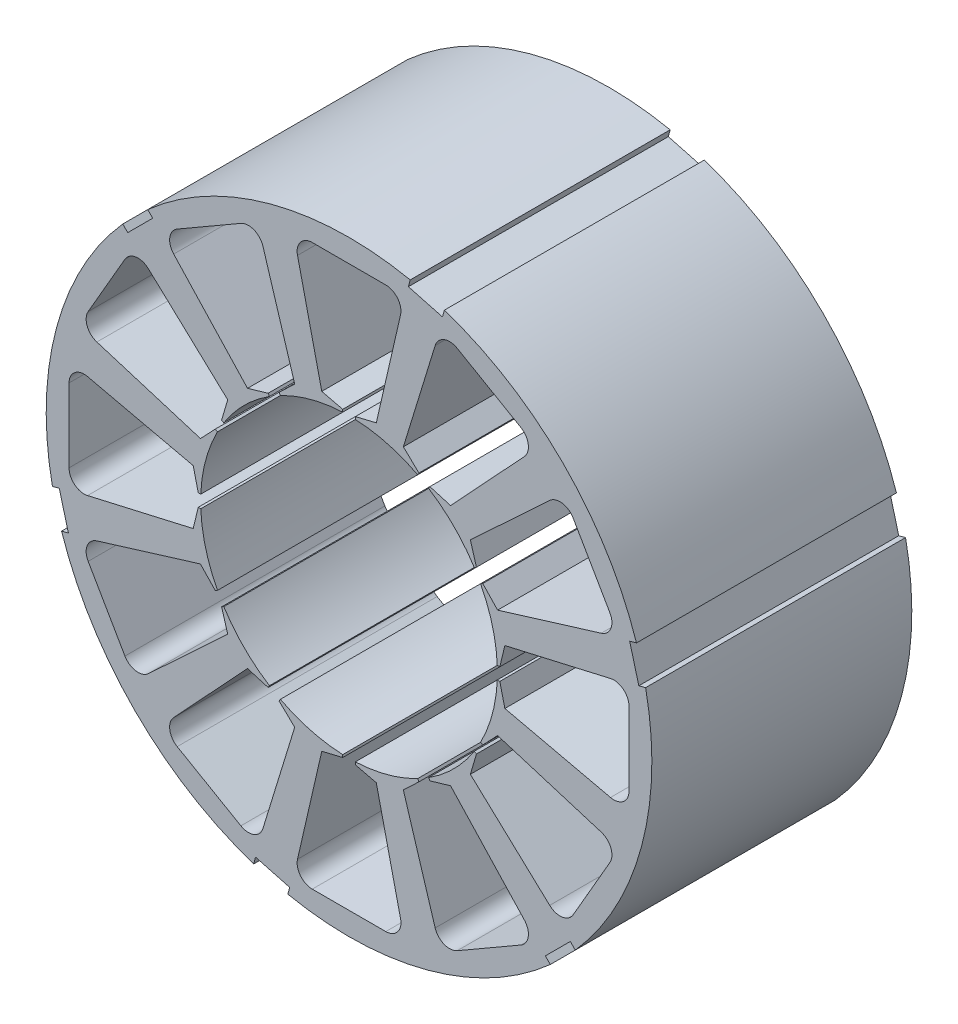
SolidWorks part; units mm, degrees
ref_plane "Přední rovina" through (0, 0, 0) normal (0, 0, 1) x (1, 0, 0)
ref_plane "Horní rovina" through (0, 0, 0) normal (0, 1, 0) x (1, 0, 0)
ref_plane "Pravá rovina" through (0, 0, 0) normal (1, 0, 0) x (0, 0, -1)
sketch "Skica1" plane through (0, 0, 0) normal (0, 0, 1) x (1, 0, 0)
  line L0 (0, 102.7157) -> (0, 0) construction
  line L1 (0, 0) -> (102.7157, 0) construction
  circle A0 centre (0, 0) radius 60
  dimension "D1" = 120
extrude "Přidat vysunutím1" add sketch "Skica1" along normal blind 51.5
sketch "Skica2" plane through (0, 0, 51.5) normal (0, 0, 1) x (1, 0, 0)
  circle A0 centre (0, 0) radius 29.4
  dimension "D1" = 58.8
extrude "Odebrat vysunutím1" cut sketch "Skica2" against normal blind 51.5
sketch "Skica3" plane through (0, 0, 51.5) normal (0, 0, 1) x (1, 0, 0)
  line L2 (0, 0) -> (0, 60) construction
  line L124 (1.25, 29.3734) -> (-1.25, 29.3734)
  line L422 (60, 0) -> (0, 0) construction
  line L423 (1.25, 29.3734) -> (1.25, 29.8734)
  line L424 (1.25, 29.8734) -> (5.4, 30.8734)
  line L425 (5.4, 30.8734) -> (10.2067, 51.8019)
  line L426 (7.2829, 55.4734) -> (-7.2829, 55.4734)
  line L427 (-5.4, 30.8734) -> (-10.2067, 51.8019)
  line L428 (-1.25, 29.8734) -> (-5.4, 30.8734)
  line L429 (-1.25, 29.3734) -> (-1.25, 29.8734)
  line L430 (20.1132, 24.0372) -> (34.7402, 39.7584)
  line L431 (34.0439, 44.4) -> (21.4296, 51.6828)
  line L432 (10.7602, 29.4372) -> (17.0616, 49.9651)
  line L433 (15.7692, 24.8131) -> (13.6042, 26.0631)
  line L434 (13.6042, 26.0631) -> (13.8542, 26.4961)
  line L435 (15.7692, 24.8131) -> (16.0192, 25.2461)
  line L436 (16.0192, 25.2461) -> (20.1132, 24.0372)
  line L437 (13.8542, 26.4961) -> (10.7602, 29.4372)
  line L438 (29.4372, 10.7602) -> (49.9651, 17.0616)
  line L439 (51.6828, 21.4296) -> (44.4, 34.0439)
  line L440 (24.0372, 20.1132) -> (39.7584, 34.7402)
  line L441 (26.0631, 13.6042) -> (24.8131, 15.7692)
  line L442 (24.8131, 15.7692) -> (25.2461, 16.0192)
  line L443 (26.0631, 13.6042) -> (26.4961, 13.8542)
  line L444 (26.4961, 13.8542) -> (29.4372, 10.7602)
  line L445 (25.2461, 16.0192) -> (24.0372, 20.1132)
  line L446 (30.8734, -5.4) -> (51.8019, -10.2067)
  line L447 (55.4734, -7.2829) -> (55.4734, 7.2829)
  line L448 (30.8734, 5.4) -> (51.8019, 10.2067)
  line L449 (29.3734, -1.25) -> (29.3734, 1.25)
  line L450 (29.3734, 1.25) -> (29.8734, 1.25)
  line L451 (29.3734, -1.25) -> (29.8734, -1.25)
  line L452 (29.8734, -1.25) -> (30.8734, -5.4)
  line L453 (29.8734, 1.25) -> (30.8734, 5.4)
  line L454 (24.0372, -20.1132) -> (39.7584, -34.7402)
  line L455 (44.4, -34.0439) -> (51.6828, -21.4296)
  line L456 (29.4372, -10.7602) -> (49.9651, -17.0616)
  line L457 (24.8131, -15.7692) -> (26.0631, -13.6042)
  line L458 (26.0631, -13.6042) -> (26.4961, -13.8542)
  line L459 (24.8131, -15.7692) -> (25.2461, -16.0192)
  line L460 (25.2461, -16.0192) -> (24.0372, -20.1132)
  line L461 (26.4961, -13.8542) -> (29.4372, -10.7602)
  line L462 (10.7602, -29.4372) -> (17.0616, -49.9651)
  line L463 (21.4296, -51.6828) -> (34.0439, -44.4)
  line L464 (20.1132, -24.0372) -> (34.7402, -39.7584)
  line L465 (13.6042, -26.0631) -> (15.7692, -24.8131)
  line L466 (15.7692, -24.8131) -> (16.0192, -25.2461)
  line L467 (13.6042, -26.0631) -> (13.8542, -26.4961)
  line L468 (13.8542, -26.4961) -> (10.7602, -29.4372)
  line L469 (16.0192, -25.2461) -> (20.1132, -24.0372)
  line L470 (-5.4, -30.8734) -> (-10.2067, -51.8019)
  line L471 (-7.2829, -55.4734) -> (7.2829, -55.4734)
  line L472 (5.4, -30.8734) -> (10.2067, -51.8019)
  line L473 (-1.25, -29.3734) -> (1.25, -29.3734)
  line L474 (1.25, -29.3734) -> (1.25, -29.8734)
  line L475 (-1.25, -29.3734) -> (-1.25, -29.8734)
  line L476 (-1.25, -29.8734) -> (-5.4, -30.8734)
  line L477 (1.25, -29.8734) -> (5.4, -30.8734)
  line L478 (-20.1132, -24.0372) -> (-34.7402, -39.7584)
  line L479 (-34.0439, -44.4) -> (-21.4296, -51.6828)
  line L480 (-10.7602, -29.4372) -> (-17.0616, -49.9651)
  line L481 (-15.7692, -24.8131) -> (-13.6042, -26.0631)
  line L482 (-13.6042, -26.0631) -> (-13.8542, -26.4961)
  line L483 (-15.7692, -24.8131) -> (-16.0192, -25.2461)
  line L484 (-16.0192, -25.2461) -> (-20.1132, -24.0372)
  line L485 (-13.8542, -26.4961) -> (-10.7602, -29.4372)
  line L486 (-29.4372, -10.7602) -> (-49.9651, -17.0616)
  line L487 (-51.6828, -21.4296) -> (-44.4, -34.0439)
  line L488 (-24.0372, -20.1132) -> (-39.7584, -34.7402)
  line L489 (-26.0631, -13.6042) -> (-24.8131, -15.7692)
  line L490 (-24.8131, -15.7692) -> (-25.2461, -16.0192)
  line L491 (-26.0631, -13.6042) -> (-26.4961, -13.8542)
  line L492 (-26.4961, -13.8542) -> (-29.4372, -10.7602)
  line L493 (-25.2461, -16.0192) -> (-24.0372, -20.1132)
  line L494 (-30.8734, 5.4) -> (-51.8019, 10.2067)
  line L495 (-55.4734, 7.2829) -> (-55.4734, -7.2829)
  line L496 (-30.8734, -5.4) -> (-51.8019, -10.2067)
  line L497 (-29.3734, 1.25) -> (-29.3734, -1.25)
  line L498 (-29.3734, -1.25) -> (-29.8734, -1.25)
  line L499 (-29.3734, 1.25) -> (-29.8734, 1.25)
  line L500 (-29.8734, 1.25) -> (-30.8734, 5.4)
  line L501 (-29.8734, -1.25) -> (-30.8734, -5.4)
  line L502 (-24.0372, 20.1132) -> (-39.7584, 34.7402)
  line L503 (-44.4, 34.0439) -> (-51.6828, 21.4296)
  line L504 (-29.4372, 10.7602) -> (-49.9651, 17.0616)
  line L505 (-24.8131, 15.7692) -> (-26.0631, 13.6042)
  line L506 (-26.0631, 13.6042) -> (-26.4961, 13.8542)
  line L507 (-24.8131, 15.7692) -> (-25.2461, 16.0192)
  line L508 (-25.2461, 16.0192) -> (-24.0372, 20.1132)
  line L509 (-26.4961, 13.8542) -> (-29.4372, 10.7602)
  line L510 (-10.7602, 29.4372) -> (-17.0616, 49.9651)
  line L511 (-21.4296, 51.6828) -> (-34.0439, 44.4)
  line L512 (-20.1132, 24.0372) -> (-34.7402, 39.7584)
  line L513 (-13.6042, 26.0631) -> (-15.7692, 24.8131)
  line L514 (-15.7692, 24.8131) -> (-16.0192, 25.2461)
  line L515 (-13.6042, 26.0631) -> (-13.8542, 26.4961)
  line L516 (-13.8542, 26.4961) -> (-10.7602, 29.4372)
  line L517 (-16.0192, 25.2461) -> (-20.1132, 24.0372)
  arc A0 (-7.2829, 55.4734) -> (-10.2067, 51.8019) centre (-7.2829, 52.4734) ccw
  circle A80 centre (0, 0) radius 60 construction
  arc A82 (7.2829, 55.4734) -> (10.2067, 51.8019) centre (7.2829, 52.4734) cw
  arc A83 (34.0439, 44.4) -> (34.7402, 39.7584) centre (32.5439, 41.8019) cw
  arc A84 (21.4296, 51.6828) -> (17.0616, 49.9651) centre (19.9296, 49.0847) ccw
  arc A85 (51.6828, 21.4296) -> (49.9651, 17.0616) centre (49.0847, 19.9296) cw
  arc A86 (44.4, 34.0439) -> (39.7584, 34.7402) centre (41.8019, 32.5439) ccw
  arc A87 (55.4734, -7.2829) -> (51.8019, -10.2067) centre (52.4734, -7.2829) cw
  arc A88 (55.4734, 7.2829) -> (51.8019, 10.2067) centre (52.4734, 7.2829) ccw
  arc A89 (44.4, -34.0439) -> (39.7584, -34.7402) centre (41.8019, -32.5439) cw
  arc A90 (51.6828, -21.4296) -> (49.9651, -17.0616) centre (49.0847, -19.9296) ccw
  arc A91 (21.4296, -51.6828) -> (17.0616, -49.9651) centre (19.9296, -49.0847) cw
  arc A92 (34.0439, -44.4) -> (34.7402, -39.7584) centre (32.5439, -41.8019) ccw
  arc A93 (-7.2829, -55.4734) -> (-10.2067, -51.8019) centre (-7.2829, -52.4734) cw
  arc A94 (7.2829, -55.4734) -> (10.2067, -51.8019) centre (7.2829, -52.4734) ccw
  arc A95 (-34.0439, -44.4) -> (-34.7402, -39.7584) centre (-32.5439, -41.8019) cw
  arc A96 (-21.4296, -51.6828) -> (-17.0616, -49.9651) centre (-19.9296, -49.0847) ccw
  arc A97 (-51.6828, -21.4296) -> (-49.9651, -17.0616) centre (-49.0847, -19.9296) cw
  arc A98 (-44.4, -34.0439) -> (-39.7584, -34.7402) centre (-41.8019, -32.5439) ccw
  arc A99 (-55.4734, 7.2829) -> (-51.8019, 10.2067) centre (-52.4734, 7.2829) cw
  arc A100 (-55.4734, -7.2829) -> (-51.8019, -10.2067) centre (-52.4734, -7.2829) ccw
  arc A101 (-44.4, 34.0439) -> (-39.7584, 34.7402) centre (-41.8019, 32.5439) cw
  arc A102 (-51.6828, 21.4296) -> (-49.9651, 17.0616) centre (-49.0847, 19.9296) ccw
  arc A103 (-21.4296, 51.6828) -> (-17.0616, 49.9651) centre (-19.9296, 49.0847) cw
  arc A104 (-34.0439, 44.4) -> (-34.7402, 39.7584) centre (-32.5439, 41.8019) ccw
  point P13 (0, 55.4734)
  point P16 (0, 29.3734)
  point P18 (-11.05, 55.4734)
  point P21 (11.05, 55.4734)
  point P156 (0, 0)
  dimension "D8" = 3
  dimension "D7" = 24.6
  dimension "D1" = 29.4
  dimension "D2" = 22.1
  dimension "D3" = 0.5
  dimension "D4" = 2.5
  dimension "D5" = 10.8
  dimension "D6" = 26.1
extrude "Odebrat vysunutím2" cut sketch "Skica3" against normal blind 51.5
sketch "Skica5" plane through (0, 0, 51.5) normal (0, 0, 1) x (1, 0, 0)
  line L0 (0, 0) -> (15.5291, 57.9555) construction
  line L1 (0, 0) -> (57.9555, -15.5291) construction
  line L2 (12.1484, 58.8614) -> (18.9099, 57.0497)
  line L3 (18.9099, 57.0497) -> (18.5217, 55.6008)
  line L4 (18.5217, 55.6008) -> (11.7602, 57.4125)
  line L5 (12.1484, 58.8614) -> (11.7602, 57.4125)
  line L6 (57.0497, 18.9099) -> (55.6008, 18.5217)
  line L7 (57.0497, 18.9099) -> (58.8614, 12.1484)
  line L8 (57.4125, 11.7602) -> (55.6008, 18.5217)
  line L9 (58.8614, 12.1484) -> (57.4125, 11.7602)
  line L10 (44.9013, -39.9515) -> (43.8406, -38.8909)
  line L11 (44.9013, -39.9515) -> (39.9515, -44.9013)
  line L12 (38.8909, -43.8406) -> (43.8406, -38.8909)
  line L13 (39.9515, -44.9013) -> (38.8909, -43.8406)
  line L14 (-12.1484, -58.8614) -> (-11.7602, -57.4125)
  line L15 (-12.1484, -58.8614) -> (-18.9099, -57.0497)
  line L16 (-18.5217, -55.6008) -> (-11.7602, -57.4125)
  line L17 (-18.9099, -57.0497) -> (-18.5217, -55.6008)
  line L18 (-57.0497, -18.9099) -> (-55.6008, -18.5217)
  line L19 (-57.0497, -18.9099) -> (-58.8614, -12.1484)
  line L20 (-57.4125, -11.7602) -> (-55.6008, -18.5217)
  line L21 (-58.8614, -12.1484) -> (-57.4125, -11.7602)
  line L22 (-44.9013, 39.9515) -> (-43.8406, 38.8909)
  line L23 (-44.9013, 39.9515) -> (-39.9515, 44.9013)
  line L24 (-38.8909, 43.8406) -> (-43.8406, 38.8909)
  line L25 (-39.9515, 44.9013) -> (-38.8909, 43.8406)
  point P9 (15.1409, 56.5067)
  point P31 (0, 0)
  dimension "D2" = 6
  dimension "D1" = 1.5
  dimension "D3" = 7
  dimension "D4" = 60
extrude "Odebrat vysunutím3" cut sketch "Skica5" against normal blind 51.5
